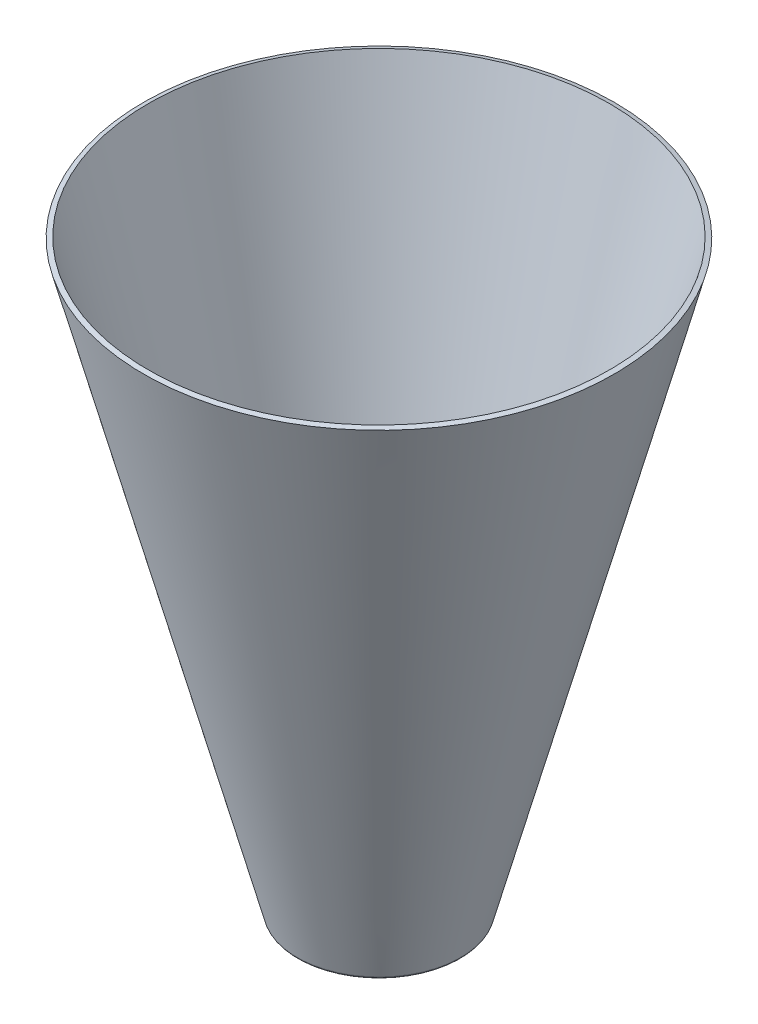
SolidWorks part; units mm, degrees
ref_plane "Plan de face" through (0, 0, 0) normal (0, 0, 1) x (1, 0, 0)
ref_plane "Plan de dessus" through (0, 0, 0) normal (0, 1, 0) x (1, 0, 0)
ref_plane "Plan de coté" through (0, 0, 0) normal (1, 0, 0) x (0, 0, -1)
sketch "Esquisse1" plane through (0, 0, 0) normal (0, 0, 1) x (1, 0, 0)
  line L0 (0, 0) -> (0, 82.109) construction
  line L1 (25.1966, 0.7448) -> (72.5, 180)
  line L2 (24.2297, 0) -> (5, 0)
  arc A0 (25.1966, 0.7448) -> (24.2297, 0) centre (24.2297, 1) cw
  point P8 (25, 0)
  dimension "D5" = 1
  dimension "D1" = 50
  dimension "D2" = 180
  dimension "D3" = 145
  dimension "D4" = 10
revolve "Révol.-Mince1" add sketch "Esquisse1" angle 360 about L0
